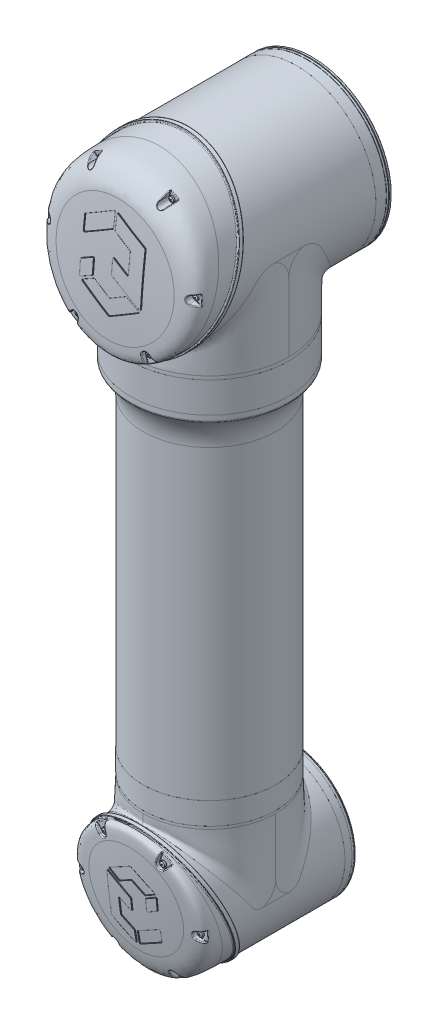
SolidWorks part; units mm, degrees
ref_plane "前视基准面" through (0, 0, 0) normal (0, 0, 1) x (1, 0, 0)
ref_plane "上视基准面" through (0, 0, 0) normal (0, 1, 0) x (1, 0, 0)
ref_plane "右视基准面" through (0, 0, 0) normal (1, 0, 0) x (0, 0, -1)
imported_body "40关节-C-1-solid1"
imported_body "40关节-C-1-solid2"
imported_body "40关节-C-1-surface1"
imported_body "C25上臂组件-1-solid1"
imported_body "C25上臂组件-1-solid2"
imported_body "C25上臂组件-1-solid3"
imported_body "C25上臂组件-1-solid4"
imported_body "C25上臂组件-1-solid5"
imported_body "32-1-solid1"
imported_body "32-1-solid2"
imported_body "32-1-solid3"
imported_body "32-1-solid4"
imported_body "32-1-solid5"
imported_body "32-1-solid6"
imported_body "32-1-solid7"
imported_body "32-1-solid8"
imported_body "32-1-solid9"
imported_body "32-1-solid10"
imported_body "32-1-solid11"
imported_body "32-1-solid12"
imported_body "32-1-solid13"
imported_body "32-1-solid14"
imported_body "32-1-solid15"
imported_body "32-1-solid16"
ref_plane "基准面1" through (0, -260, 0) normal (0, 1, 0) x (1, 0, 0)
split "分割1" trim tools "基准面1" bodies to split 113 resulting bodies 130 131
other "移动面1" parameters "D1"=100
move or copy body "实体-移动/复制1" bodies to move or copy 130 112 107 111 106 108 copy no translate (0, -100, 0)
combine bodies "组合1" operation type add bodies to combine 133 132
